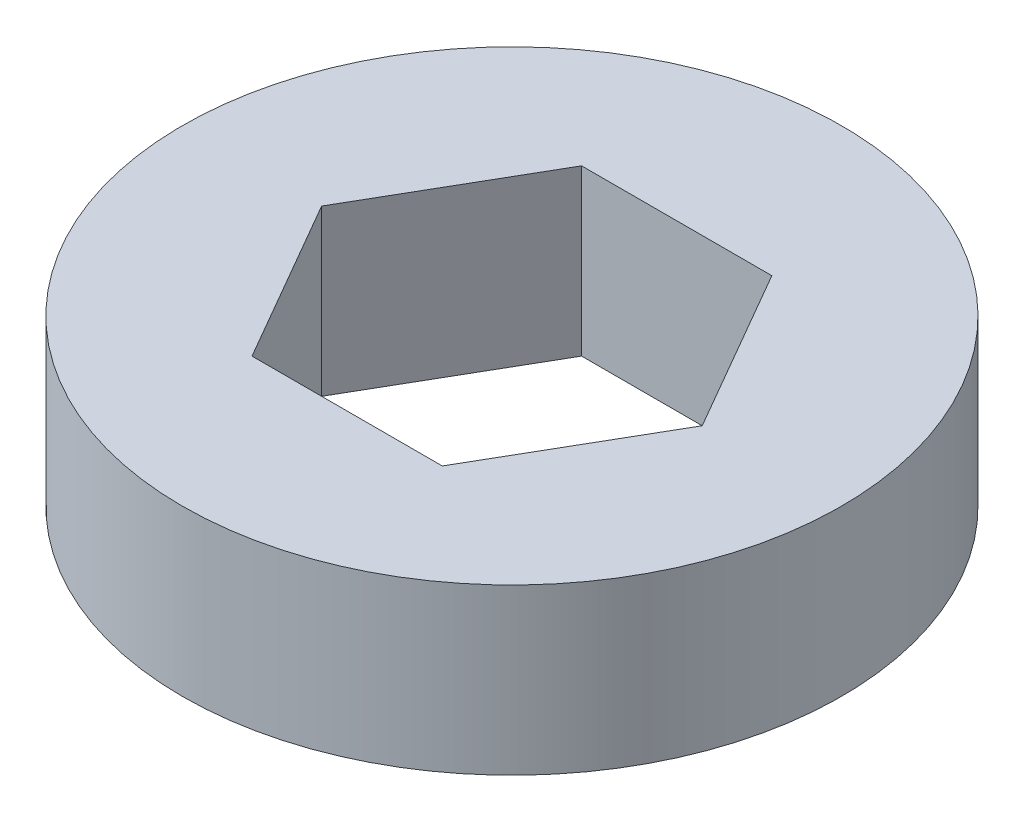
SolidWorks part; units mm, degrees
ref_plane "Front Plane" through (0, 0, 0) normal (0, 0, 1) x (1, 0, 0)
ref_plane "Top Plane" through (0, 0, 0) normal (0, 1, 0) x (1, 0, 0)
ref_plane "Right Plane" through (0, 0, 0) normal (1, 0, 0) x (0, 0, -1)
sketch "Sketch1" plane through (0, 0, 0) normal (0, 1, 0) x (1, 0, 0)
  line L1 (11.547, 0) -> (5.7735, 10)
  line L2 (5.7735, 10) -> (-5.7735, 10)
  line L3 (-5.7735, 10) -> (-11.547, 0)
  line L4 (-11.547, 0) -> (-5.7735, -10)
  line L5 (-5.7735, -10) -> (5.7735, -10)
  line L6 (5.7735, -10) -> (11.547, 0)
  circle A0 centre (0, 0) radius 10 construction
  circle A1 centre (0, 0) radius 20
extrude "Boss-Extrude1" add sketch "Sketch1" along normal blind 10
